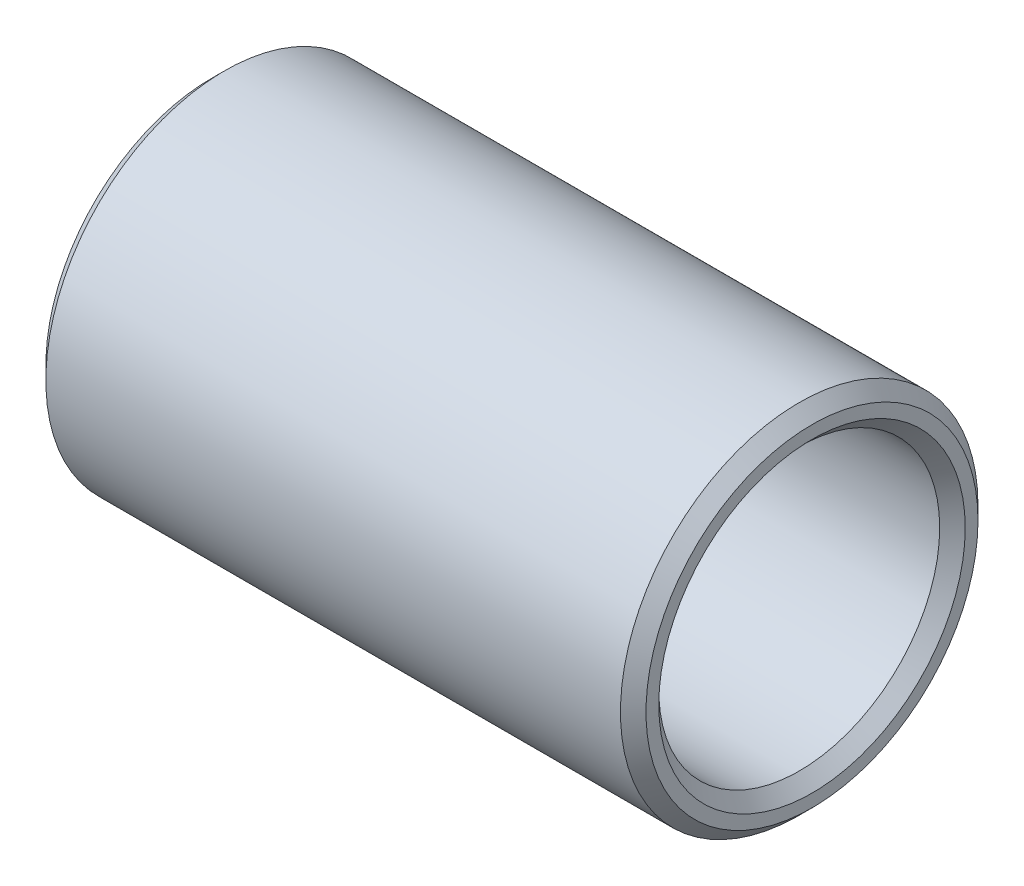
SolidWorks part; units mm, degrees
ref_plane "Plan de face" through (0, 0, 0) normal (0, 0, 1) x (1, 0, 0)
ref_plane "Plan de dessus" through (0, 0, 0) normal (0, 1, 0) x (1, 0, 0)
ref_plane "Plan de droite" through (0, 0, 0) normal (1, 0, 0) x (0, 0, -1)
sketch "Esquisse1" plane through (0, 0, 0) normal (0, 0, 1) x (1, 0, 0)
  line L0 (0, 12) -> (1, 11)
  line L1 (1, 11) -> (46, 11)
  line L2 (46, 11) -> (47, 12)
  line L3 (47, 12) -> (47, 13)
  line L4 (47, 13) -> (46, 14)
  line L5 (46, 14) -> (1, 14)
  line L6 (1, 14) -> (0, 13)
  line L7 (0, 13) -> (0, 12)
  line L8 (47, 0) -> (0, 0) construction
revolve "Révolution1" add sketch "Esquisse1" angle 360 about L8
ref_plane "Plan1" through (-5, 0, 0) normal (1, 0, 0) x (0, 0, -1)
